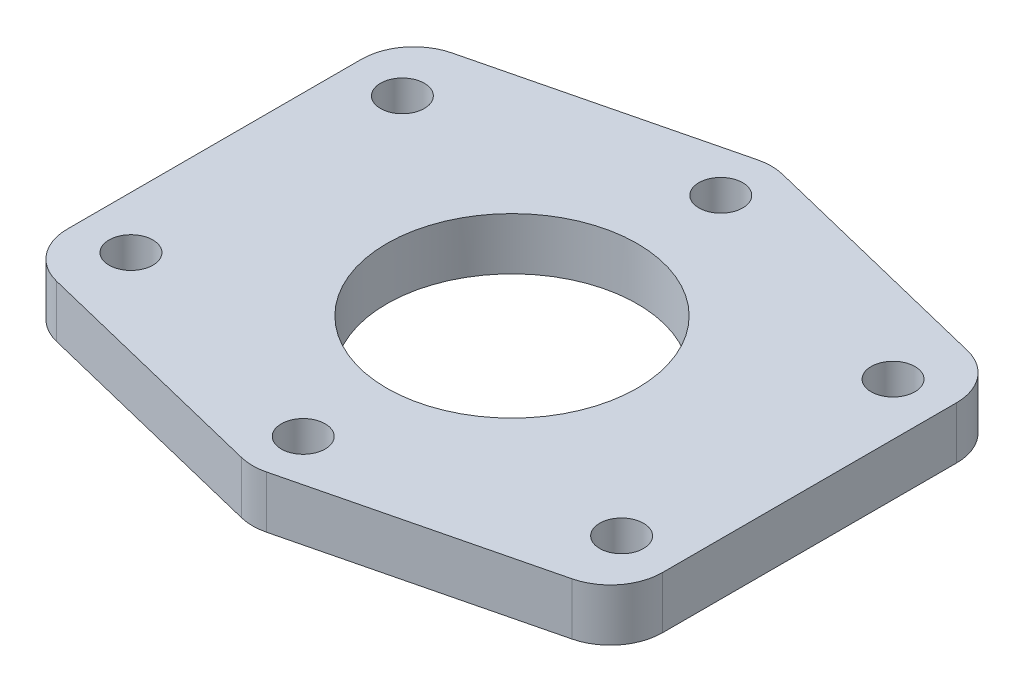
SolidWorks part; units mm, degrees
ref_plane "前视基准面" through (0, 0, 0) normal (0, 0, 1) x (1, 0, 0)
ref_plane "上视基准面" through (0, 0, 0) normal (0, 1, 0) x (1, 0, 0)
ref_plane "右视基准面" through (0, 0, 0) normal (1, 0, 0) x (0, 0, -1)
sketch "草图1" plane through (0, 0, 0) normal (0, 1, 0) x (1, 0, 0)
  line L1 (-28.5, -18) -> (28.5, -18)
  line L2 (-28.5, -18) -> (-28.5, 18)
  line L3 (-28.5, 18) -> (28.5, 18)
  line L4 (28.5, -18) -> (28.5, 18)
  line L5 (-28.5, -18) -> (28.5, 18) construction
  line L6 (-28.5, 18) -> (28.5, -18) construction
  circle A0 centre (-23.5, 13) radius 2.1
  circle A1 centre (-23.5, -13) radius 2.1
  circle A2 centre (23.5, 13) radius 2.1
  circle A3 centre (23.5, -13) radius 2.1
  point P0 (0, 0)
  dimension "D1" = 23.5
  dimension "D2" = 23.5
  dimension "D3" = 23.5
  dimension "D4" = 23.5
  dimension "D5" = 13
  dimension "D6" = 13
  dimension "D7" = 13
  dimension "D8" = 13
  dimension "D9" = 4.2
  dimension "D10" = 4.2
  dimension "D11" = 4.2
  dimension "D12" = 4.2
  dimension "D13" = 57
  dimension "D14" = 36
extrude "凸台-拉伸1" add sketch "草图1" along normal blind 5
sketch "草图2" plane through (0, 5, 0) normal (0, 1, 0) x (1, 0, 0)
  circle A0 centre (0, 0) radius 12
  dimension "D1" = 24
extrude "切除-拉伸1" cut sketch "草图2" against normal through all both and the other way through all
sketch "草图3" plane through (0, 0, 0) normal (0, 1, 0) x (1, 0, 0)
  line L0 (-28.5, 18) -> (0, 25)
  line L1 (0, 25) -> (28.5, 18)
  line L2 (28.5, 18) -> (-28.5, 18)
  line L3 (-28.5, -18) -> (0, -25)
  line L4 (0, -25) -> (28.5, -18)
  line L5 (28.5, -18) -> (-28.5, -18)
  point P10 (18.0404, 25)
  point P12 (18.0404, -25)
  dimension "D1" = 25
  dimension "D2" = 25
  dimension "D3" = 0
  dimension "D4" = 0
extrude "凸台-拉伸4" add sketch "草图3" along normal blind 5
sketch "草图4" plane through (0, 0, 0) normal (0, 1, 0) x (1, 0, 0)
  circle A0 centre (0, 20) radius 2.1
  circle A1 centre (0, -20) radius 2.1
  point P4 (5.8957, -19.1113)
  point P6 (10.4898, 17.0284)
  dimension "D1" = 4.2
  dimension "D2" = 4.2
  dimension "D4" = 20
  dimension "D3" = 20
  dimension "D5" = 0
  dimension "D6" = 0
extrude "切除-拉伸4" cut sketch "草图4" along normal through all both and the other way through all contours A0 | A1
fillet "圆角1" radius 5 6 edges at (-28.5, 2.5, -18) (-28.5, 2.5, 18) (28.5, 2.5, 18) (28.5, 2.5, -18) (0, 2.5, -25) (0, 2.5, 25)
